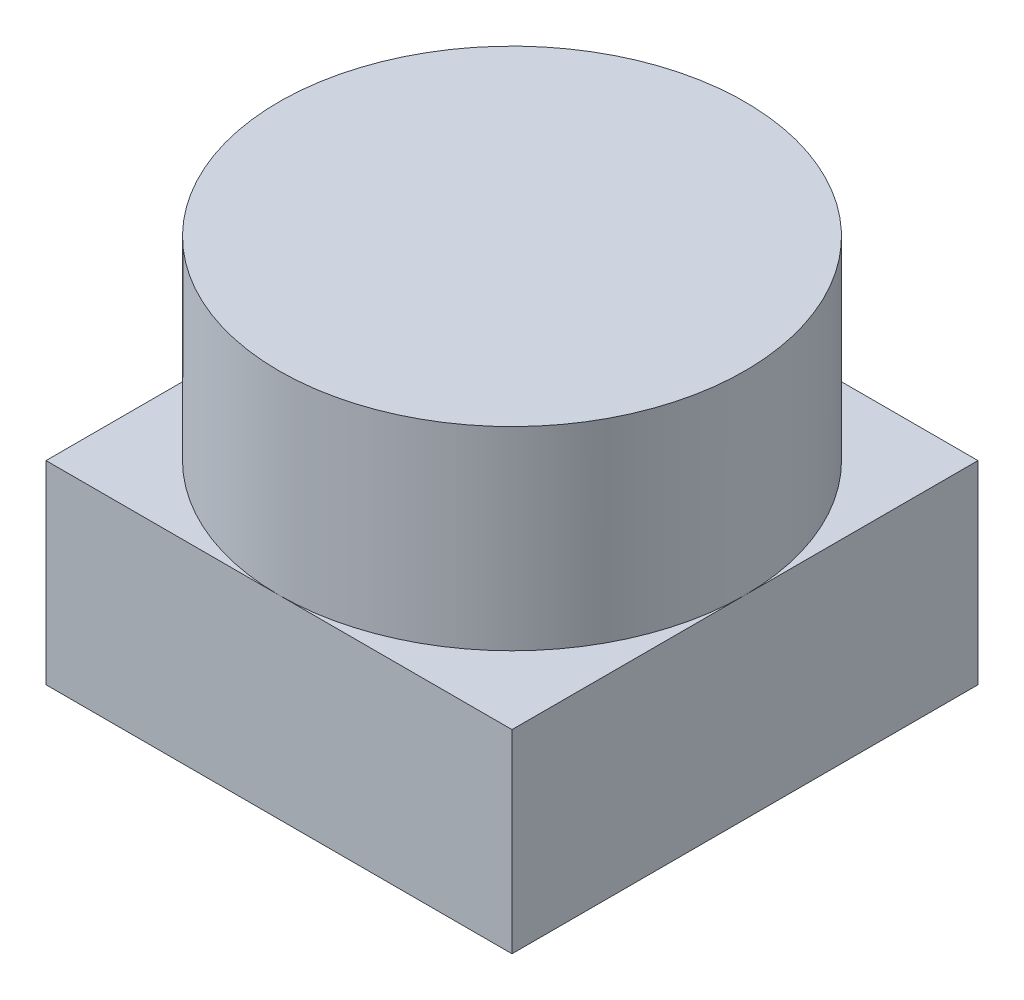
SolidWorks part; units mm, degrees
ref_plane "Front Plane" through (0, 0, 0) normal (0, 0, 1) x (1, 0, 0)
ref_plane "Top Plane" through (0, 0, 0) normal (0, 1, 0) x (1, 0, 0)
ref_plane "Right Plane" through (0, 0, 0) normal (1, 0, 0) x (0, 0, -1)
sketch "Sketch1" plane through (0, 0, 0) normal (0, 1, 0) x (1, 0, 0)
  line L1 (0, 0) -> (12, 0)
  line L2 (0, 0) -> (0, 12)
  line L3 (0, 12) -> (12, 12)
  line L4 (12, 0) -> (12, 12)
  dimension "D1" = 12
  dimension "D2" = 12
extrude "Boss-Extrude1" add sketch "Sketch1" along normal blind 5
sketch "Sketch2" plane through (0, 5, 0) normal (0, 1, 0) x (1, 0, 0)
  line L0 (0, 12) -> (12, 0) construction
  line L1 (0, 0) -> (12, 12) construction
  line L2 (0, 12) -> (0, 0) construction
  circle A0 centre (6, 6) radius 6
extrude "Boss-Extrude2" add sketch "Sketch2" along normal blind 5
